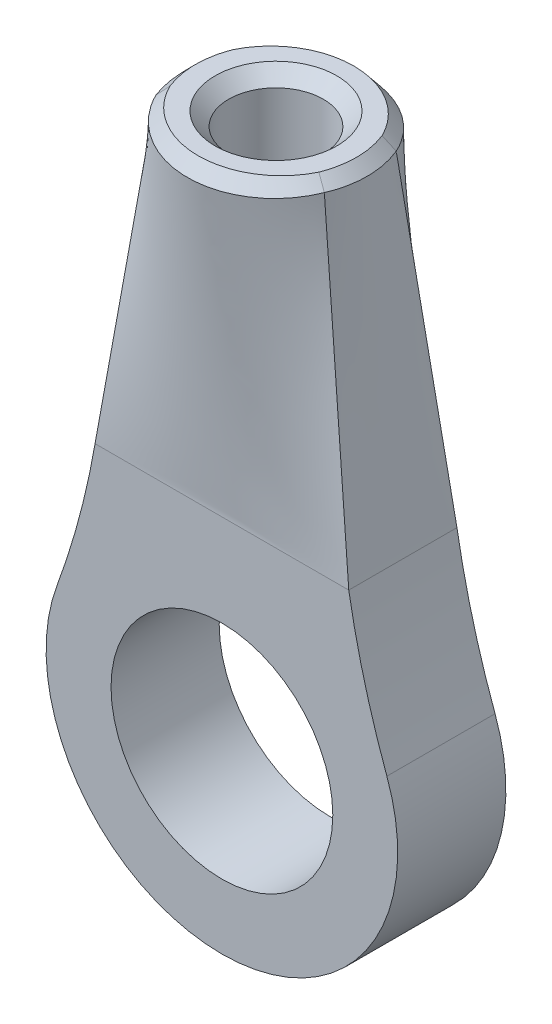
SolidWorks part; units mm, degrees
ref_plane "Спереди" through (0, 0, 0) normal (0, 0, 1) x (1, 0, 0)
ref_plane "Сверху" through (0, 0, 0) normal (0, 1, 0) x (1, 0, 0)
ref_plane "Справа" through (0, 0, 0) normal (1, 0, 0) x (0, 0, -1)
other "Configuration Table"
sketch "Эскиз1" plane through (0, 0, 0) normal (0, 0, 1) x (1, 0, 0)
  circle A0 centre (0, 0) radius 6.5
  circle A1 centre (0, 0) radius 4.1
  dimension "D1" = 8.2
  dimension "D2" = 13
extrude "Бобышка-Вытянуть1" add sketch "Эскиз1" along normal blind 4
sketch "Эскиз2" plane through (0, 0, 4) normal (0, 0, 1) x (1, 0, 0)
  line L0 (-4.6904, 4.5) -> (4.6904, 4.5) construction
  line L2 (-4.6904, 4.5) -> (4.6904, 4.5)
  line L3 (-4.6904, 4.5) -> (-4.6904, 7.5)
  line L4 (-4.6904, 7.5) -> (4.6904, 7.5)
  line L5 (4.6904, 4.5) -> (4.6904, 7.5)
  circle A0 centre (0, 0) radius 6.5 construction
  dimension "D1" = 4.5
  dimension "D2" = 3
extrude "Бобышка-Вытянуть2" add sketch "Эскиз2" against normal blind 4
ref_plane "Плоскость1" through (0, 19.5, 0) normal (0, 1, 0) x (1, 0, 0)
sketch "Эскиз3" plane through (0, 19.5, 0) normal (0, 1, 0) x (1, 0, 0)
  line L0 (0, 0) -> (0, -4) construction
  line L1 (4.6904, -4) -> (-4.6904, -4) construction
  circle A1 centre (0, -2) radius 3.33
  dimension "D2" = 6.66
sketch "Эскиз4" plane through (0, 7.5, 0) normal (0, 1, 0) x (1, 0, 0)
  line L4 (-4.6904, -4) -> (4.6904, -4)
  line L5 (4.6904, -4) -> (4.6904, 0)
  line L6 (4.6904, 0) -> (-4.6904, 0)
  line L7 (-4.6904, 0) -> (-4.6904, -4)
  line L8 (-4.6904, -4) -> (4.6904, -4)
  line L9 (4.6904, -4) -> (4.6904, 0)
  line L10 (4.6904, 0) -> (-4.6904, 0)
  line L11 (-4.6904, 0) -> (-4.6904, -4)
  dimension "D1" = 0
loft "По сечениям1" add profiles "Эскиз3", "Эскиз4"
fillet "Скругление1" radius 30 2 edges at (4.6904, 4.5, 2) (-4.6904, 4.5, 2)
sketch "Эскиз5" plane through (0, 19.5, 0) normal (0, 1, 0) x (1, 0, 0)
  circle A0 centre (0, -2) radius 1.75
  dimension "D1" = 3.5
extrude "Вырез-Вытянуть1" cut sketch "Эскиз5" against normal blind 13
chamfer "Фаска1" distance 0.5 angle 45 5 edges at (0, 19.5, 3.75)
sketch3d "Трехмерный эскиз1"
  line L0 (0, 19.5, 2) -> (0, 19, 2) construction
  line L1 (0, 19.5, 2) -> (0, 26.5095, 2) construction
  point P0 (0, 19.5, 2)
